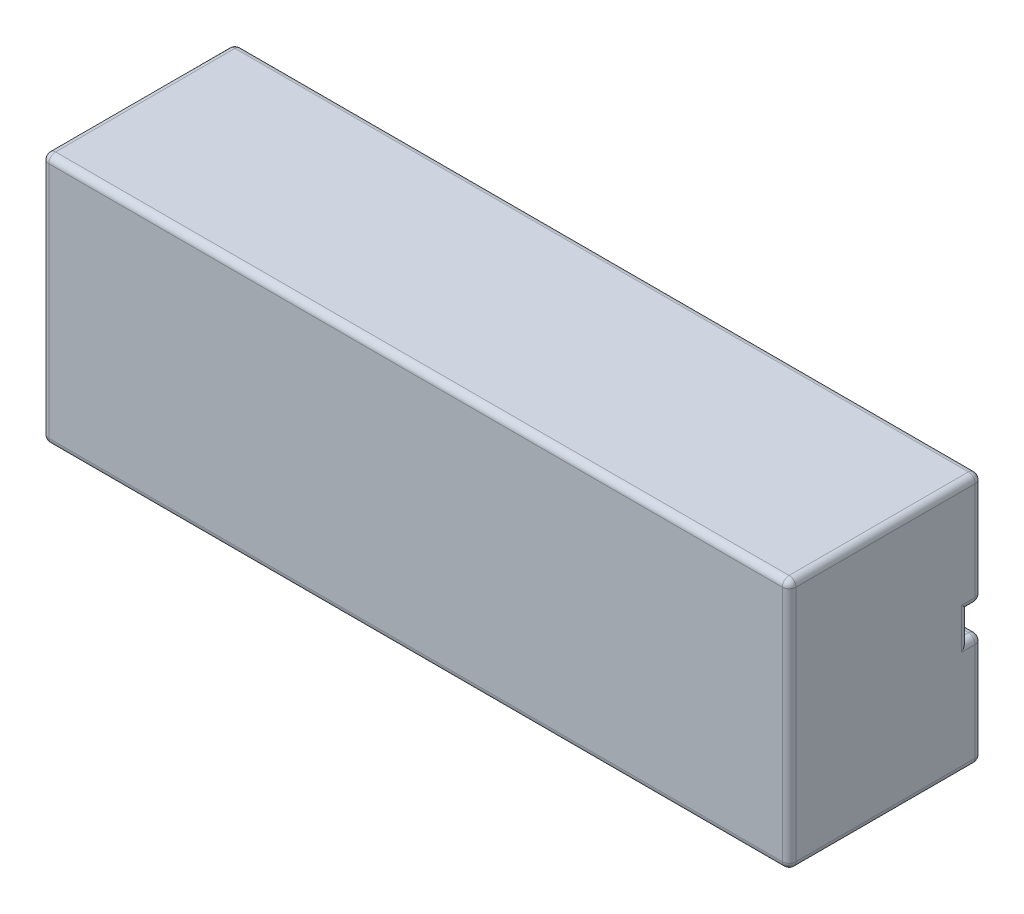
SolidWorks part; units mm, degrees
ref_plane "Front Plane" through (0, 0, 0) normal (0, 0, 1) x (1, 0, 0)
ref_plane "Top Plane" through (0, 0, 0) normal (0, 1, 0) x (1, 0, 0)
ref_plane "Right Plane" through (0, 0, 0) normal (1, 0, 0) x (0, 0, -1)
sketch "Sketch2" plane through (0, 0, 0) normal (0, 0, 1) x (1, 0, 0)
  line L1 (0, 0) -> (139.7, 0)
  line L2 (0, 0) -> (0, 46.99)
  line L3 (0, 46.99) -> (139.7, 46.99)
  line L4 (139.7, 0) -> (139.7, 46.99)
  dimension "D1" = 139.7
  dimension "D2" = 46.99
extrude "Boss-Extrude1" add sketch "Sketch2" along normal blind 36.068
fillet "Fillet1" radius 1.27 1 edges at (69.85, 46.99, 36.068)
sketch "Sketch6" plane through (139.7, 0, 0) normal (1, 0, 0) x (0, 0, -1)
  line L0 (0, 0) -> (0, 46.99) construction
  line L1 (0, 26.035) -> (-2.54, 26.035)
  line L2 (0, 26.035) -> (0, 20.955)
  line L3 (0, 20.955) -> (-2.54, 20.955)
  line L4 (-2.54, 26.035) -> (-2.54, 20.955)
  line L5 (-34.798, 46.99) -> (0, 46.99) construction
  dimension "D1" = 20.955
  dimension "D2" = 5.08
  dimension "D3" = 2.54
extrude "Cut-Extrude3" cut sketch "Sketch6" against normal blind 2.54
fillet "Fillet3" radius 1.27 20 edges at (0, 46.618, 35.696) (0, 0, 18.034) (137.16, 23.495, 0) (138.43, 26.035, 0) (0, 23.495, 0) (69.85, 0, 0) (138.43, 20.955, 0) (139.7, 0, 18.034) (139.7, 46.618, 35.696) (139.7, 36.5125, 0) (139.7, 26.035, 1.27) (139.7, 23.495, 2.54) (139.7, 20.955, 1.27) (139.7, 10.4775, 0) (69.85, 0, 36.068) (0, 22.86, 36.068) (139.7, 22.86, 36.068) (69.85, 46.99, 0) (139.7, 46.99, 17.399) (0, 46.99, 17.399)
sketch "Sketch7" plane through (0, 0, 0) normal (0, 0, -1) x (-1, 0, 0)
  line L0 (-123.7411, 33.9136) -> (-19.0364, 33.9136) construction
  text T0 "3S LIPO BATTERY EC5 7200 mAH 11.1V 120 C" font "Times New Roman" height 3.175
extrude "Cut-Extrude4" cut sketch "Sketch7" against normal blind 1.27
